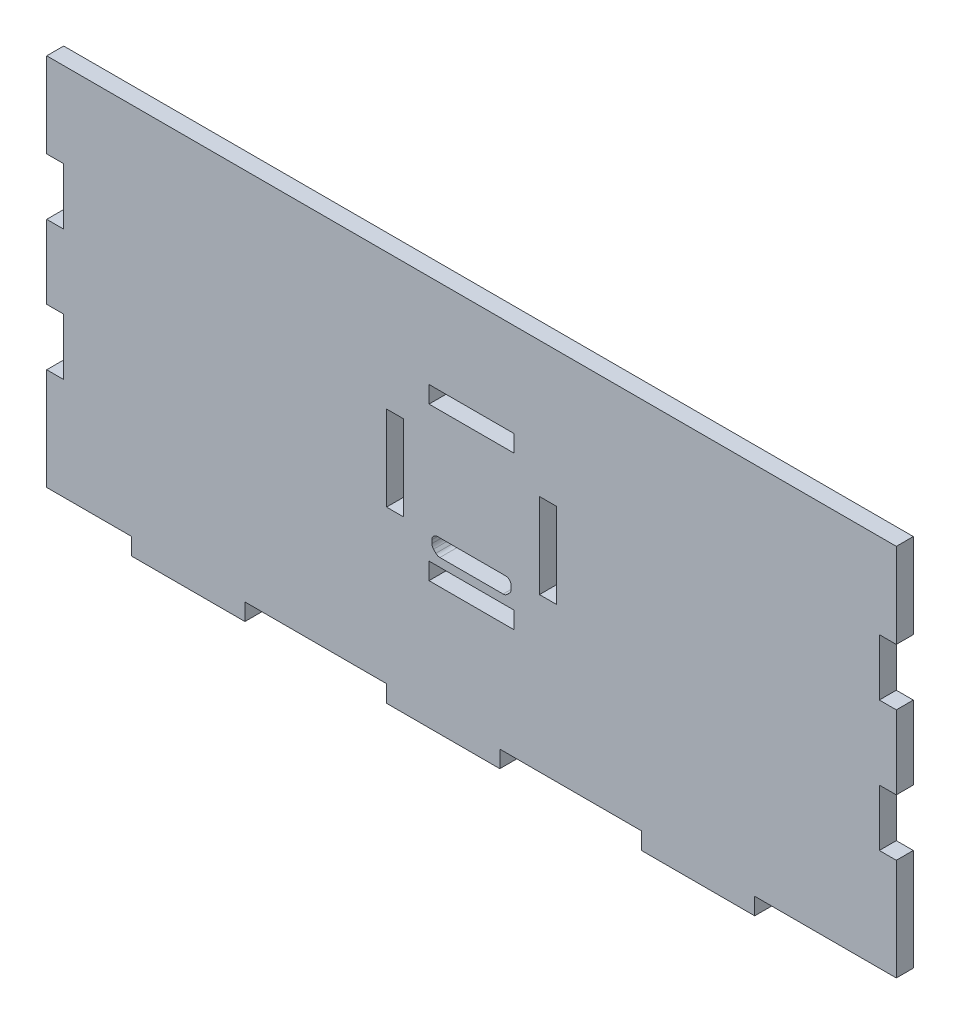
SolidWorks part; units mm, degrees
ref_plane "Alzado" through (0, 0, 0) normal (0, 0, 1) x (1, 0, 0)
ref_plane "Planta" through (0, 0, 0) normal (0, 1, 0) x (1, 0, 0)
ref_plane "Vista lateral" through (0, 0, 0) normal (1, 0, 0) x (0, 0, -1)
sketch "Croquis1" plane through (0, 0, 0) normal (0, 0, 1) x (1, 0, 0)
  line L1 (0, 0) -> (150, 0)
  line L2 (0, 0) -> (0, 75)
  line L3 (0, 75) -> (150, 75)
  line L4 (150, 0) -> (150, 75)
extrude "Saliente-Extruir1" add sketch "Croquis1" along normal blind 3
sketch "Croquis2" plane through (0, 0, 3) normal (0, 0, 1) x (1, 0, 0)
  line L24 (150, 69) -> (150, 75)
  line L71 (125, 3) -> (150, 3)
  line L80 (150, 0) -> (150, 75) construction
  line L81 (80, 3) -> (105, 3)
  line L82 (35, 3) -> (60, 3)
  line L83 (0, 3) -> (15, 3)
  line L84 (0, 0) -> (0, 3)
  line L85 (15, 0) -> (0, 0)
  line L86 (15, 3) -> (15, 0)
  line L87 (35, 0) -> (35, 3)
  line L88 (60, 0) -> (35, 0)
  line L89 (60, 3) -> (60, 0)
  line L90 (80, 0) -> (80, 3)
  line L91 (105, 0) -> (80, 0)
  line L92 (105, 3) -> (105, 0)
  line L93 (150, 3) -> (150, 0)
  line L94 (125, 0) -> (125, 3)
  line L95 (150, 0) -> (125, 0)
  line L96 (150, 54) -> (147, 54)
  line L97 (147, 54) -> (147, 44)
  line L98 (147, 44) -> (150, 44)
  line L99 (150, 44) -> (150, 54)
  line L100 (0, 21) -> (3, 21)
  line L101 (0, 44) -> (0, 54)
  line L102 (3, 44) -> (0, 44)
  line L103 (3, 54) -> (3, 44)
  line L104 (0, 54) -> (3, 54)
  line L105 (3, 21) -> (3, 31)
  line L106 (3, 31) -> (0, 31)
  line L107 (0, 31) -> (0, 21)
  line L108 (150, 31) -> (150, 21)
  line L109 (147, 31) -> (150, 31)
  line L110 (147, 21) -> (147, 31)
  line L111 (150, 21) -> (147, 21)
  line L113 (82.5, 52.5) -> (82.5, 49.5)
  line L119 (63, 45) -> (60, 45)
  line L124 (63, 45) -> (63, 30)
  line L125 (63, 30) -> (60, 30)
  line L126 (82.5, 52.5) -> (67.5, 52.5)
  line L130 (82.5, 49.5) -> (67.5, 49.5)
  line L131 (67.5, 49.5) -> (67.5, 52.5)
  line L132 (67.5, 25.5) -> (82.5, 25.5)
  line L133 (67.5, 25.5) -> (67.5, 22.5)
  line L134 (67.5, 22.5) -> (82.5, 22.5)
  line L135 (82.5, 25.5) -> (82.5, 22.5)
  line L136 (87, 45.1219) -> (87, 30.1219)
  line L141 (90, 37.6219) -> (90, 45.1219)
  line L142 (90, 45.1219) -> (87, 45.1219)
  line L143 (87, 30.1219) -> (90, 30.1219)
  line L144 (90, 30.1219) -> (90, 37.6219)
  line L145 (60, 45) -> (60, 30)
  line L150 (0, 75) -> (0, 0) construction
  line L151 (0, 69) -> (0, 75)
  line L152 (0, 75) -> (150, 75)
  line L164 (68.2929, 27.7071) -> (68.7071, 27.2929)
  line L165 (75, 27) -> (80.5858, 27)
  line L166 (82, 28.4142) -> (82, 29)
  line L167 (81, 30) -> (69, 30)
  line L168 (68, 29) -> (68, 28.4142)
  line L169 (69.4142, 27) -> (75, 27)
  line L170 (81.2929, 27.2929) -> (81.7071, 27.7071)
  line L172 (0, 69) -> (150, 69)
  arc A8 (69.4142, 27) -> (68.7071, 27.2929) centre (69.4142, 28) cw
  arc A9 (68.2929, 27.7071) -> (68, 28.4142) centre (69, 28.4142) cw
  arc A10 (80.5858, 27) -> (81.2929, 27.2929) centre (80.5858, 28) ccw
  arc A11 (82, 28.4142) -> (81.7071, 27.7071) centre (81, 28.4142) cw
  arc A12 (82, 29) -> (81, 30) centre (81, 29) ccw
  arc A13 (69, 30) -> (68, 29) centre (69, 29) ccw
  point P43 (82, 27)
  point P60 (68, 27)
  point P65 (75, 49.5)
  point P76 (87, 37.5)
  point P83 (69, 27)
  point P86 (68, 28)
  point P89 (81, 27)
  point P92 (82, 28)
  dimension "D1" = 1
extrude "Cortar-Extruir1" cut sketch "Croquis2" against normal blind 6
